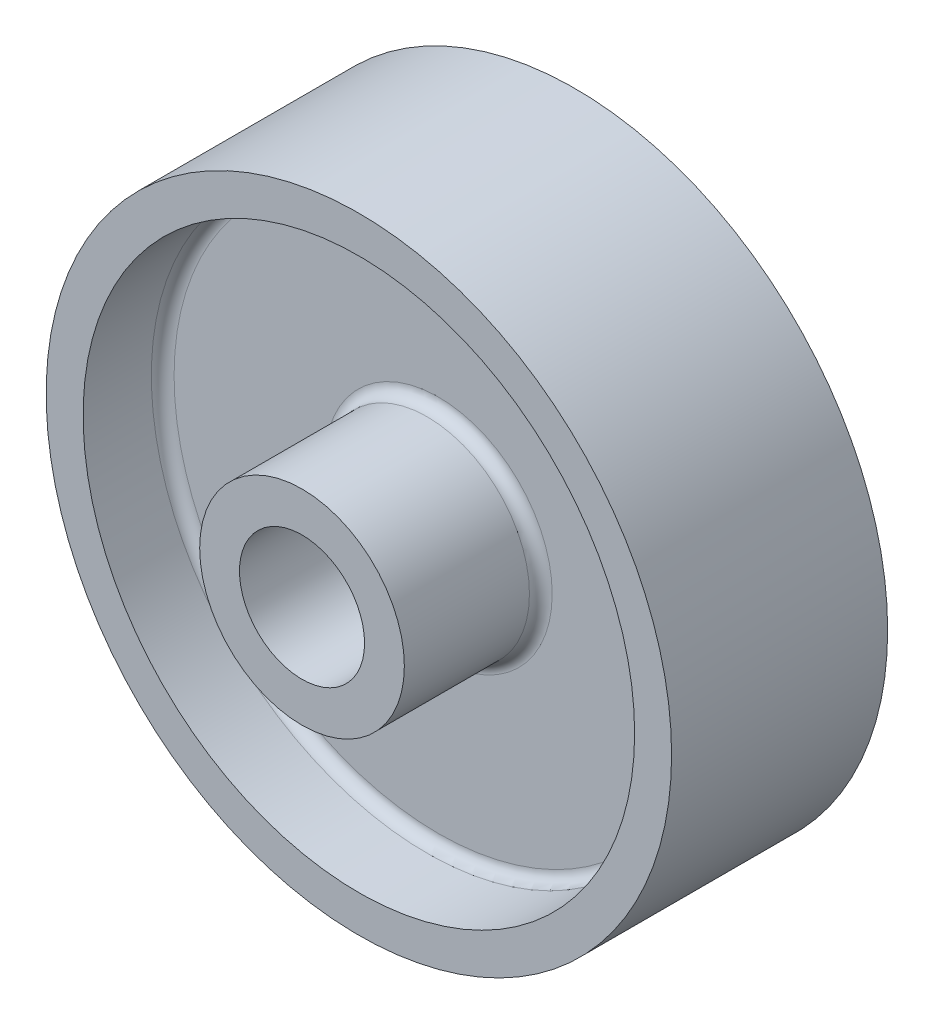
SolidWorks part; units mm, degrees
ref_plane "Front Plane" through (0, 0, 0) normal (0, 0, 1) x (1, 0, 0)
ref_plane "Top Plane" through (0, 0, 0) normal (0, 1, 0) x (1, 0, 0)
ref_plane "Right Plane" through (0, 0, 0) normal (1, 0, 0) x (0, 0, -1)
sketch "Sketch1" plane through (0, 0, 0) normal (1, 0, 0) x (0, 0, -1)
  line L0 (-44.4602, 0) -> (50.4071, 0) construction
  line L1 (-29, 11) -> (29, 11)
  line L2 (0, 0) -> (0, 11) construction
  line L3 (29, 18) -> (7, 18)
  line L4 (-19, 55) -> (19, 55)
  line L6 (-5, 46.5) -> (-5, 20)
  line L8 (5, 46.5) -> (5, 20)
  line L9 (-29, 18) -> (-29, 11)
  line L10 (-7, 48.5) -> (-19, 48.5)
  line L11 (-7, 18) -> (-29, 18)
  line L12 (29, 18) -> (29, 11)
  line L13 (19, 55) -> (19, 48.5)
  line L14 (19, 48.5) -> (7, 48.5)
  line L15 (-19, 48.5) -> (-19, 55)
  line L16 (0, 0) -> (0, 84.0874) construction
  arc A0 (5, 20) -> (7, 18) centre (7, 20) ccw
  arc A1 (-5, 20) -> (-7, 18) centre (-7, 20) cw
  arc A2 (7, 48.5) -> (5, 46.5) centre (7, 46.5) ccw
  arc A3 (-7, 48.5) -> (-5, 46.5) centre (-7, 46.5) cw
  point P22 (-5, 18)
  dimension "D9" = 2
  dimension "D1" = 22
  dimension "D2" = 36
  dimension "D3" = 97
  dimension "D4" = 110
  dimension "D5" = 58
  dimension "D6" = 38
  dimension "D7" = 10
  dimension "D8" = 14
revolve "Revolve1" add sketch "Sketch1" angle 360 about L0
